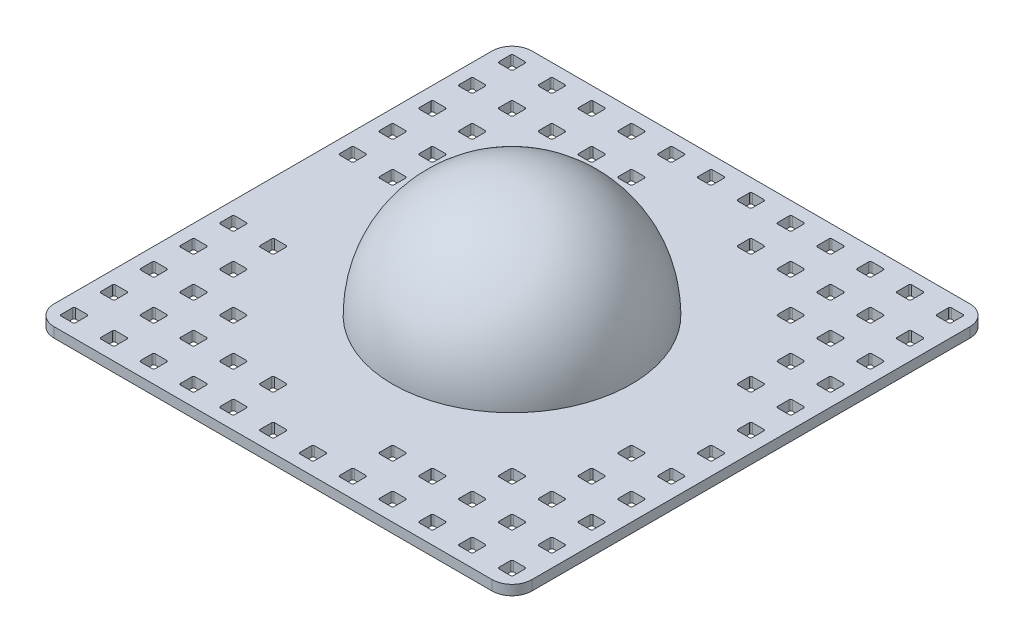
SolidWorks part; units mm, degrees
ref_plane "Front Plane" through (0, 0, 0) normal (0, 0, 1) x (1, 0, 0)
ref_plane "Top Plane" through (0, 0, 0) normal (0, 1, 0) x (1, 0, 0)
ref_plane "Right Plane" through (0, 0, 0) normal (1, 0, 0) x (0, 0, -1)
sketch "Sketch1" plane through (0, 0, 0) normal (0, 1, 0) x (1, 0, 0)
  line L0 (0, 38.1) -> (0, -38.1)
  arc A0 (0, -38.1) -> (0, 38.1) centre (0, 0) ccw
  dimension "D1" = 76.2
revolve "Revolve3" add sketch "Sketch1" angle 360 about L0
sketch "Sketch2" plane through (0, 0, 0) normal (0, 1, 0) x (1, 0, 0)
  line L0 (-38.1, -38.1) -> (38.1, -38.1)
  line L1 (-38.1, -38.1) -> (-38.1, 38.1)
  line L2 (38.1, -38.1) -> (38.1, 38.1)
  line L3 (-38.1, 38.1) -> (38.1, 38.1)
  line L4 (-38.1, -38.1) -> (38.1, 38.1) construction
  line L5 (38.1, -38.1) -> (-38.1, 38.1) construction
  circle A0 centre (0, 0) radius 38.1 construction
  point P1 (0, 0)
extrude "Cut-Extrude1" cut sketch "Sketch2" against normal through all
sketch "Sketch3" plane through (0, 0, 0) normal (0, 1, 0) x (1, 0, 0)
  line L1 (-76.2, 76.2) -> (76.2, 76.2)
  line L2 (-76.2, 76.2) -> (-76.2, -76.2)
  line L3 (-76.2, -76.2) -> (76.2, -76.2)
  line L4 (76.2, 76.2) -> (76.2, -76.2)
  line L5 (-76.2, 76.2) -> (76.2, -76.2) construction
  line L6 (-76.2, -76.2) -> (76.2, 76.2) construction
  point P0 (0, 0)
  dimension "D1" = 152.4
extrude "Boss-Extrude1" add sketch "Sketch3" against normal blind 3.175
sketch "Sketch4"
  dimension "D4" = 0.508
  dimension "D1" = 4.6228
  dimension "D2" = 6.35
  dimension "D3" = 6.35
  dimension "D7" = 12.7
  dimension "D8" = 12.7
  dimension "D5" = 12
  dimension "D6" = 12
extrude "Cut-Extrude2" cut sketch "Sketch4" against normal through all
sketch "Sketch6" plane through (0, -3.175, 0) normal (0, -1, 0) x (-1, 0, 0)
  line L0 (0, 34.925) -> (0, -34.925)
  arc A0 (0, 34.925) -> (0, -34.925) centre (0, 0) ccw
  point P4 (0, 0)
  dimension "D1" = 69.85
revolve "Cut-Revolve5" cut sketch "Sketch6" angle 360 about L0
fillet "Fillet1" radius 6.35 4 edges at (76.2, -1.5875, 76.2) (76.2, -1.5875, -76.2) (-76.2, -1.5875, -76.2) (-76.2, -1.5875, 76.2)
